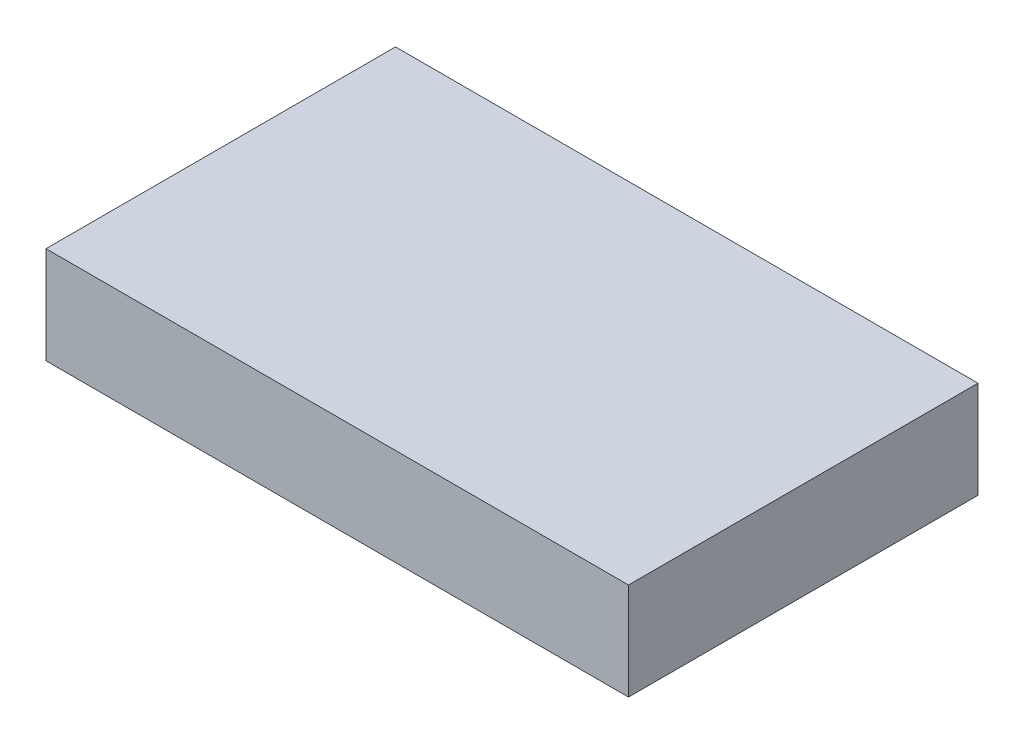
SolidWorks part; units mm, degrees
ref_plane "前视基准面" through (0, 0, 0) normal (0, 0, 1) x (1, 0, 0)
ref_plane "上视基准面" through (0, 0, 0) normal (0, 1, 0) x (1, 0, 0)
ref_plane "右视基准面" through (0, 0, 0) normal (1, 0, 0) x (0, 0, -1)
other "Configuration Table"
sketch "草图1" plane through (0, 0, 0) normal (0, 0, 1) x (1, 0, 0)
  line L1 (0, 0) -> (150, 0)
  line L2 (0, 0) -> (0, 25)
  line L3 (0, 25) -> (150, 25)
  line L4 (150, 0) -> (150, 25)
extrude "V2_REF_electronics_envelope" add sketch "草图1" along normal blind 90
